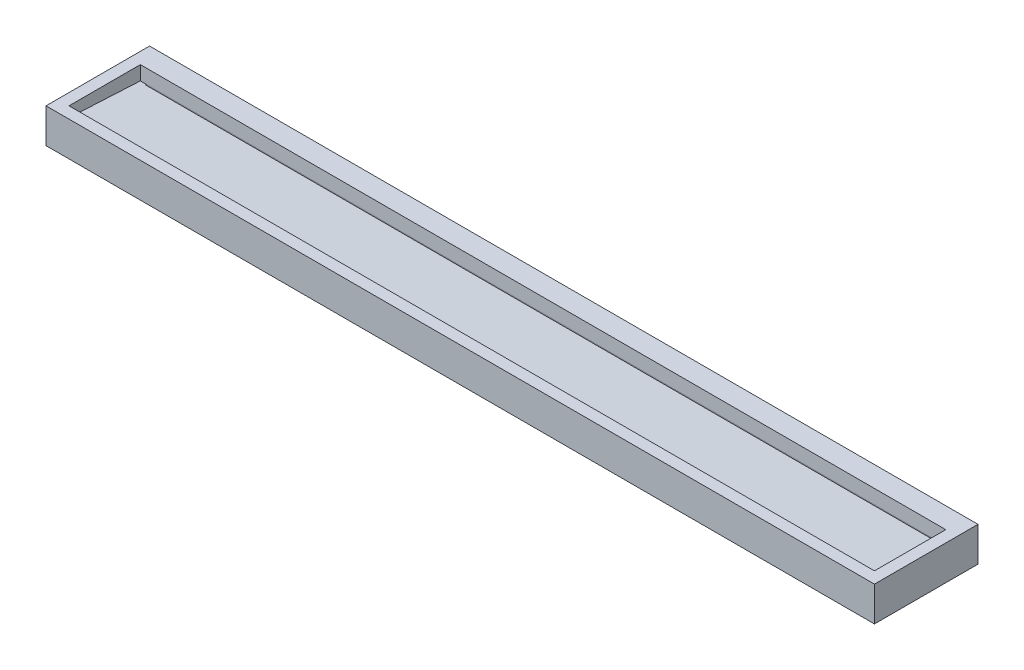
SolidWorks part; units mm, degrees
ref_plane "Front Plane" through (0, 0, 0) normal (0, 0, 1) x (1, 0, 0)
ref_plane "Top Plane" through (0, 0, 0) normal (0, 1, 0) x (1, 0, 0)
ref_plane "Right Plane" through (0, 0, 0) normal (1, 0, 0) x (0, 0, -1)
sketch "Sketch1" plane through (0, 0, 0) normal (0, 1, 0) x (1, 0, 0)
  line L1 (-1800, -225) -> (1800, -225)
  line L2 (-1800, -225) -> (-1800, 225)
  line L3 (-1800, 225) -> (1800, 225)
  line L4 (1800, -225) -> (1800, 225)
  line L5 (-1800, -225) -> (1800, 225) construction
  line L6 (-1800, 225) -> (1800, -225) construction
  point P0 (0, 0)
  dimension "D1" = 3600
  dimension "D2" = 450
extrude "Body" add sketch "Sketch1" along normal blind 150
sketch "Sketch2" plane through (1800, 0, 0) normal (1, 0, 0) x (0, 0, -1)
  line L0 (-175, 150) -> (-175, 105)
  line L1 (-225, 150) -> (225, 150) construction
  line L2 (-175, 105) -> (135, 88.7536)
  line L3 (135, 88.7536) -> (135, 150)
  line L4 (135, 150) -> (-175, 150)
  line L5 (-225, 150) -> (-225, 0) construction
  line L6 (225, 150) -> (225, 0) construction
  dimension "D1" = 50
  dimension "D2" = 45
  dimension "D3" = 93
  dimension "D4" = 90
extrude "Basin Cutout" cut sketch "Sketch2" against normal offset from surface (3500 mm away) 50 from offset 50
shell "Shell1" thickness 12
sketch "Sketch3" plane through (0, 0, -225) normal (0, 0, -1) x (-1, 0, 0)
  line L0 (-1800, 150) -> (1800, 150) construction
  line L1 (-1788, -138) -> (1788, -138)
  line L2 (-1788, -138) -> (-1788, 138)
  line L3 (-1788, 138) -> (1788, 138)
  line L4 (1788, -138) -> (1788, 138)
  line L5 (-1788, -138) -> (1788, 138) construction
  line L6 (-1788, 138) -> (1788, -138) construction
  line L7 (1800, 150) -> (1800, 0) construction
  point P0 (0, 0)
  dimension "D1" = 12
  dimension "D2" = 12
extrude "Back Cutout" cut sketch "Sketch3" against normal blind 12
sketch "Sketch4" plane through (0, 150, 0) normal (0, 1, 0) x (1, 0, 0)
  line L0 (-1800, 225) -> (-1800, -225) construction
  line L1 (-1800, 135) -> (1800, 135)
  line L2 (-1800, 135) -> (-1800, 147)
  line L3 (-1800, 147) -> (1800, 147)
  line L4 (1800, 135) -> (1800, 147)
  line L5 (1800, -225) -> (1800, 225) construction
  line L6 (-1750, 135) -> (1750, 135) construction
  line L7 (1800, -187) -> (-1800, -187)
  line L8 (1800, -187) -> (1800, -175)
  line L9 (1800, -175) -> (-1800, -175)
  line L10 (-1800, -187) -> (-1800, -175)
  line L11 (-1750, -175) -> (1750, -175) construction
  dimension "D1" = 12
  dimension "D2" = 12
extrude "Support Ribs" add sketch "Sketch4" against normal blind 97
sketch "Sketch8" plane through (0, 0, -147) normal (0, 0, -1) x (-1, 0, 0)
  line L0 (-1788, 53) -> (1788, 53) construction
  line L1 (-1595, 53) -> (-1405, 53)
  line L2 (-1595, 53) -> (-1595, 76.7371)
  line L3 (-1595, 76.7371) -> (-1405, 76.7371)
  line L4 (-1405, 53) -> (-1405, 76.7371)
  line L6 (-1800, 150) -> (-1800, 0) construction
  line L7 (-1762, 76.7371) -> (1762, 76.7371) construction
  point P6 (-1500, 76.7371)
  dimension "D1" = 190
  dimension "D2" = 300
extrude "Waste Plate Cutout" cut sketch "Sketch8" against normal blind 12
sketch "Sketch11" plane through (0, 0, 175) normal (0, 0, -1) x (-1, 0, 0)
  line L0 (-1788, 53) -> (1788, 53) construction
  line L1 (-1800, 150) -> (-1800, 0) construction
  circle A0 centre (-1765, 65.8) radius 4
  dimension "D1" = 8
  dimension "D2" = 12.8
  dimension "D3" = 35
extrude "Bracket Hole" cut sketch "Sketch11" against normal blind 12
pattern_linear "Hole Pattern" count 61 spacing 58.8333 along (-1, 0, 0) of "Bracket Hole"
sketch "Sketch12" plane through (0, 0, -147) normal (0, 0, -1) x (-1, 0, 0)
  line L0 (-1788, 138) -> (-1788, 53) construction
  line L1 (-1788, 61) -> (1788, 61)
  line L2 (-1788, 61) -> (-1788, 65)
  line L3 (-1788, 65) -> (1788, 65)
  line L4 (1788, 61) -> (1788, 65)
  line L5 (1788, 53) -> (1788, 138) construction
  line L6 (-1405, 53) -> (1788, 53) construction
  dimension "D1" = 4
  dimension "D2" = 8
extrude "Bracket Slot" cut sketch "Sketch12" against normal blind 6
sketch "Sketch9" plane through (0, 95.5662, -5.0084) normal (0, 0.9986, -0.0523) x (1, 0, 0)
  line L0 (-1750, 130.17) -> (1750, 130.17) construction
  line L1 (-1725, 130.17) -> (1725, 130.17)
  line L2 (-1725, 130.17) -> (-1725, 126.17)
  line L3 (-1725, 126.17) -> (1725, 126.17)
  line L4 (1725, 130.17) -> (1725, 126.17)
  line L5 (-1750, 130.17) -> (-1750, -180.2554) construction
  dimension "D1" = 25
  dimension "D2" = 4
  dimension "D3" = 25
extrude "Drainage Slot Long" cut sketch "Sketch9" against normal blind 6
sketch "Sketch10" plane through (0, 95.5662, -5.0084) normal (0, 0.9986, -0.0523) x (1, 0, 0)
  line L0 (1725, 130.17) -> (-1725, 130.17) construction
  line L1 (1430, 130.17) -> (1570, 130.17)
  line L2 (1430, 130.17) -> (1430, 126.17)
  line L3 (1430, 126.17) -> (1570, 126.17)
  line L4 (1570, 130.17) -> (1570, 126.17)
  line L5 (-1725, 126.17) -> (1725, 126.17) construction
  line L7 (1800, -232.542) -> (1800, 216.8413) construction
  point P8 (1500, 130.17)
  dimension "D1" = 140
  dimension "D2" = 300
extrude "Drainage Slot Short" cut sketch "Sketch10" against normal blind 12
pattern_linear "User Spacing" count 6 spacing 600 along (-1, 0, 0) of "Waste Plate Cutout", "Drainage Slot Short"
sketch "Sketch13" [suppressed] plane through (0, 150, 0) normal (0, 1, 0) x (1, 0, 0)
  line L0 (-850, 135) -> (850, 135) construction
  line L1 (-900, 225) -> (-900, -225) construction
  circle A0 centre (-525, 175) radius 17.5
  circle A1 centre (-675, 175) radius 17.5
  dimension "D1" = 35
  dimension "D2" = 40
  dimension "D3" = 375
  dimension "D5" = 150
  dimension "D4" = 2
extrude "Cut-Extrude1" [suppressed] cut sketch "Sketch13" against normal blind 12
sketch "Sketch14" [suppressed] plane through (0, 150, 0) normal (0, 1, 0) x (1, 0, 0)
  line L0 (825, 135) -> (-825, 135) construction
  circle A0 centre (-300, 175) radius 17.5
  dimension "D1" = 35
  dimension "D2" = 40
  dimension "D3" = 300
extrude "Cut-Extrude2" [suppressed] cut sketch "Sketch14" against normal blind 12 contours A0
pattern_linear "LPattern1" [suppressed] count 3 spacing 600
pattern_linear "LPattern2" [suppressed] count 2 spacing 600
